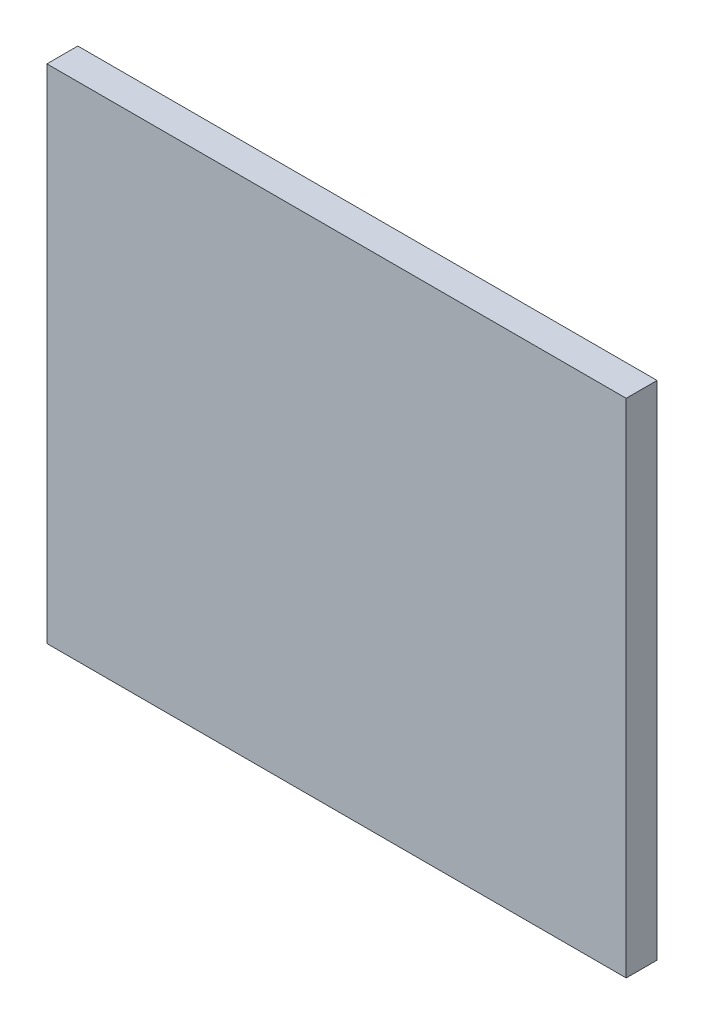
SolidWorks part; units mm, degrees
ref_plane "前视基准面" through (0, 0, 0) normal (0, 0, 1) x (1, 0, 0)
ref_plane "上视基准面" through (0, 0, 0) normal (0, 1, 0) x (1, 0, 0)
ref_plane "右视基准面" through (0, 0, 0) normal (1, 0, 0) x (0, 0, -1)
sketch "草图1" plane through (0, 0, 0) normal (0, 0, 1) x (1, 0, 0)
  line L1 (0, 0) -> (150, 0)
  line L2 (0, 0) -> (0, 130)
  line L3 (0, 130) -> (150, 130)
  line L4 (150, 0) -> (150, 130)
  dimension "D1" = 130
  dimension "D3" = 150
extrude "拉伸1" add sketch "草图1" along normal blind 8
